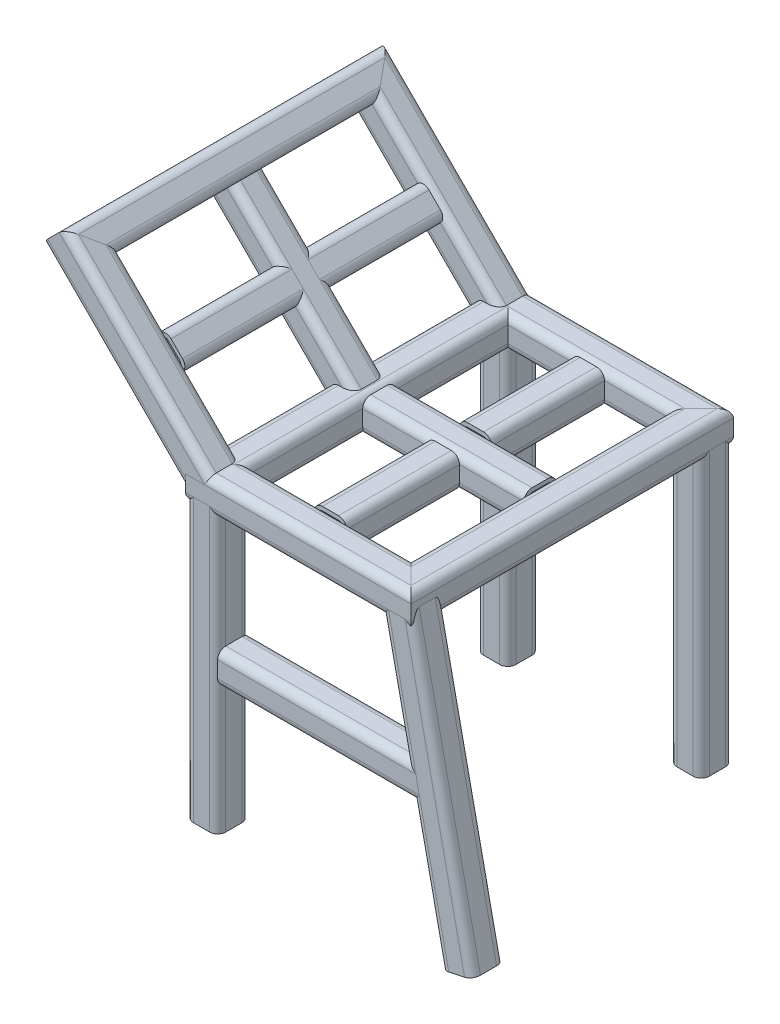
SolidWorks part; units mm, degrees
ref_plane "Front Plane" through (0, 0, 0) normal (0, 0, 1) x (1, 0, 0)
ref_plane "Top Plane" through (0, 0, 0) normal (0, 1, 0) x (1, 0, 0)
ref_plane "Right Plane" through (0, 0, 0) normal (1, 0, 0) x (0, 0, -1)
sketch "Sketch1" plane through (0, 0, 0) normal (0, 1, 0) x (1, 0, 0)
  line L0 (0, -457.2) -> (304.8, -457.2)
  line L1 (0, 0) -> (304.8, 0)
  line L2 (0, 0) -> (0, -457.2)
  line L3 (0, -228.6) -> (304.8, -228.6)
  line L4 (304.8, 0) -> (304.8, -457.2)
  line L5 (152.4, 0) -> (152.4, -228.6)
  line L6 (152.4, -228.6) -> (152.4, -457.2)
  dimension "D1" = 304.8
  dimension "D2" = 457.2
sketch3d "3DSketch1"
  line L0 (0, 0, 0) -> (-215.5261, 215.5261, 0)
  line L1 (-215.5261, 215.5261, 0) -> (-215.5261, 215.5261, 457.2)
  line L2 (-215.5261, 215.5261, 457.2) -> (0, 0, 457.2)
  line L3 (0, 0, 0) -> (0, 0, 457.2) construction
  line L4 (0, 0, 0) -> (304.8, 0, 0) construction
  line L5 (-107.7631, 107.7631, 0) -> (-107.7631, 107.7631, 457.2)
  line L6 (0, 0, 228.6) -> (-215.5261, 215.5261, 228.6)
  dimension "D1" = 304.8
  dimension "D2" = 135
  dimension "D3" = 152.4
sketch "Sketch2" plane through (0, 0, 0) normal (0, 0, 1) x (1, 0, 0)
  line L0 (0, 0) -> (0, -457.2)
  line L1 (304.8, 0) -> (304.8, -457.2)
  dimension "D1" = 457.2
ref_plane "Plane1" through (0, 0, 457.2) normal (0, 0, 1) x (1, 0, 0)
sketch "Sketch3" plane through (0, 0, 457.2) normal (0, 0, 1) x (1, 0, 0)
  line L0 (0, 0) -> (0, -457.2)
  line L1 (304.8, 0) -> (401.9809, -457.2)
  line L2 (0, -228.6) -> (353.3904, -228.6)
  dimension "D1" = 457.2
  dimension "D2" = 12
other "Structural Member1"
ref_plane "Plane5" through (-215.5261, 215.5261, 457.2) normal (0.7071, -0.7071, 0) x (0, 0, -1)
sketch "Sketch111" plane through (-215.5261, 215.5261, 457.2) normal (0.7071, -0.7071, 0) x (0, 0, -1)
  line L0 (-12.7, -19.05) -> (12.7, -19.05)
  line L1 (-19.05, -12.7) -> (-19.05, 12.7)
  line L2 (12.7, 19.05) -> (-12.7, 19.05)
  line L3 (19.05, 12.7) -> (19.05, -12.7)
  line L4 (-12.7, -25.4) -> (12.7, -25.4)
  line L5 (-25.4, -12.7) -> (-25.4, 12.7)
  line L6 (12.7, 25.4) -> (-12.7, 25.4)
  line L7 (25.4, 12.7) -> (25.4, -12.7)
  line L8 (0, 0) -> (19.05, 0) construction
  line L9 (0, 0) -> (0, 19.05) construction
  arc A0 (25.4, 12.7) -> (12.7, 25.4) centre (12.7, 12.7) ccw
  arc A1 (12.7, -25.4) -> (25.4, -12.7) centre (12.7, -12.7) ccw
  arc A2 (-25.4, -12.7) -> (-12.7, -25.4) centre (-12.7, -12.7) ccw
  arc A3 (-12.7, 25.4) -> (-25.4, 12.7) centre (-12.7, 12.7) ccw
  arc A4 (-12.7, 19.05) -> (-19.05, 12.7) centre (-12.7, 12.7) ccw
  arc A5 (19.05, 12.7) -> (12.7, 19.05) centre (12.7, 12.7) ccw
  arc A6 (12.7, -19.05) -> (19.05, -12.7) centre (12.7, -12.7) ccw
  arc A7 (-19.05, -12.7) -> (-12.7, -19.05) centre (-12.7, -12.7) ccw
  point P3 (0, 25.4)
  point P4 (25.4, 0)
  point P5 (0, -25.4)
  point P6 (-25.4, 0)
  point P7 (-25.4, 25.4)
  point P8 (-25.4, -25.4)
  point P33 (0, 0)
  point P35 (25.4, -25.4)
  point P36 (25.4, 25.4)
  point P37 (0, 0)
  dimension "D1" = 12.7
  dimension "Thickness" = 6.35
  dimension "V_leg" = 50.8
other "Structural Member2"
ref_plane "Plane6" through (0, 0, 457.2) normal (1, 0, 0) x (0, 0, -1)
sketch "Sketch15" plane through (0, 0, 457.2) normal (1, 0, 0) x (0, 0, -1)
  line L0 (-12.7, -19.05) -> (12.7, -19.05)
  line L1 (-19.05, -12.7) -> (-19.05, 12.7)
  line L2 (12.7, 19.05) -> (-12.7, 19.05)
  line L3 (19.05, 12.7) -> (19.05, -12.7)
  line L4 (-12.7, -25.4) -> (12.7, -25.4)
  line L5 (-25.4, -12.7) -> (-25.4, 12.7)
  line L6 (12.7, 25.4) -> (-12.7, 25.4)
  line L7 (25.4, 12.7) -> (25.4, -12.7)
  line L8 (0, 0) -> (19.05, 0) construction
  line L9 (0, 0) -> (0, 19.05) construction
  arc A0 (25.4, 12.7) -> (12.7, 25.4) centre (12.7, 12.7) ccw
  arc A1 (12.7, -25.4) -> (25.4, -12.7) centre (12.7, -12.7) ccw
  arc A2 (-25.4, -12.7) -> (-12.7, -25.4) centre (-12.7, -12.7) ccw
  arc A3 (-12.7, 25.4) -> (-25.4, 12.7) centre (-12.7, 12.7) ccw
  arc A4 (-12.7, 19.05) -> (-19.05, 12.7) centre (-12.7, 12.7) ccw
  arc A5 (19.05, 12.7) -> (12.7, 19.05) centre (12.7, 12.7) ccw
  arc A6 (12.7, -19.05) -> (19.05, -12.7) centre (12.7, -12.7) ccw
  arc A7 (-19.05, -12.7) -> (-12.7, -19.05) centre (-12.7, -12.7) ccw
  point P3 (0, 25.4)
  point P4 (25.4, 0)
  point P5 (0, -25.4)
  point P6 (-25.4, 0)
  point P7 (-25.4, 25.4)
  point P8 (-25.4, -25.4)
  point P33 (0, 0)
  point P35 (25.4, -25.4)
  point P36 (25.4, 25.4)
  point P37 (0, 0)
  dimension "D1" = 12.7
  dimension "Thickness" = 6.35
  dimension "V_leg" = 50.8
other "Structural Member3"
ref_plane "Plane7" through (0, 0, 0) normal (0, -1, 0) x (1, 0, 0)
sketch "Sketch16" plane through (0, 0, 0) normal (0, -1, 0) x (1, 0, 0)
  line L0 (-12.7, -19.05) -> (12.7, -19.05)
  line L1 (-19.05, -12.7) -> (-19.05, 12.7)
  line L2 (12.7, 19.05) -> (-12.7, 19.05)
  line L3 (19.05, 12.7) -> (19.05, -12.7)
  line L4 (-12.7, -25.4) -> (12.7, -25.4)
  line L5 (-25.4, -12.7) -> (-25.4, 12.7)
  line L6 (12.7, 25.4) -> (-12.7, 25.4)
  line L7 (25.4, 12.7) -> (25.4, -12.7)
  line L8 (0, 0) -> (19.05, 0) construction
  line L9 (0, 0) -> (0, 19.05) construction
  arc A0 (25.4, 12.7) -> (12.7, 25.4) centre (12.7, 12.7) ccw
  arc A1 (12.7, -25.4) -> (25.4, -12.7) centre (12.7, -12.7) ccw
  arc A2 (-25.4, -12.7) -> (-12.7, -25.4) centre (-12.7, -12.7) ccw
  arc A3 (-12.7, 25.4) -> (-25.4, 12.7) centre (-12.7, 12.7) ccw
  arc A4 (-12.7, 19.05) -> (-19.05, 12.7) centre (-12.7, 12.7) ccw
  arc A5 (19.05, 12.7) -> (12.7, 19.05) centre (12.7, 12.7) ccw
  arc A6 (12.7, -19.05) -> (19.05, -12.7) centre (12.7, -12.7) ccw
  arc A7 (-19.05, -12.7) -> (-12.7, -19.05) centre (-12.7, -12.7) ccw
  point P3 (0, 25.4)
  point P4 (25.4, 0)
  point P5 (0, -25.4)
  point P6 (-25.4, 0)
  point P7 (-25.4, 25.4)
  point P8 (-25.4, -25.4)
  point P33 (0, 0)
  point P35 (25.4, -25.4)
  point P36 (25.4, 25.4)
  point P37 (0, 0)
  dimension "D1" = 12.7
  dimension "Thickness" = 6.35
  dimension "V_leg" = 50.8
other "Structural Member4"
ref_plane "Plane8" through (0, 0, 457.2) normal (0, -1, 0) x (1, 0, 0)
sketch "Sketch17" plane through (0, 0, 457.2) normal (0, -1, 0) x (1, 0, 0)
  line L0 (-12.7, -19.05) -> (12.7, -19.05)
  line L1 (-19.05, -12.7) -> (-19.05, 12.7)
  line L2 (12.7, 19.05) -> (-12.7, 19.05)
  line L3 (19.05, 12.7) -> (19.05, -12.7)
  line L4 (-12.7, -25.4) -> (12.7, -25.4)
  line L5 (-25.4, -12.7) -> (-25.4, 12.7)
  line L6 (12.7, 25.4) -> (-12.7, 25.4)
  line L7 (25.4, 12.7) -> (25.4, -12.7)
  line L8 (0, 0) -> (19.05, 0) construction
  line L9 (0, 0) -> (0, 19.05) construction
  arc A0 (25.4, 12.7) -> (12.7, 25.4) centre (12.7, 12.7) ccw
  arc A1 (12.7, -25.4) -> (25.4, -12.7) centre (12.7, -12.7) ccw
  arc A2 (-25.4, -12.7) -> (-12.7, -25.4) centre (-12.7, -12.7) ccw
  arc A3 (-12.7, 25.4) -> (-25.4, 12.7) centre (-12.7, 12.7) ccw
  arc A4 (-12.7, 19.05) -> (-19.05, 12.7) centre (-12.7, 12.7) ccw
  arc A5 (19.05, 12.7) -> (12.7, 19.05) centre (12.7, 12.7) ccw
  arc A6 (12.7, -19.05) -> (19.05, -12.7) centre (12.7, -12.7) ccw
  arc A7 (-19.05, -12.7) -> (-12.7, -19.05) centre (-12.7, -12.7) ccw
  point P3 (0, 25.4)
  point P4 (25.4, 0)
  point P5 (0, -25.4)
  point P6 (-25.4, 0)
  point P7 (-25.4, 25.4)
  point P8 (-25.4, -25.4)
  point P33 (0, 0)
  point P35 (25.4, -25.4)
  point P36 (25.4, 25.4)
  point P37 (0, 0)
  dimension "D1" = 12.7
  dimension "Thickness" = 6.35
  dimension "V_leg" = 50.8
other "Structural Member5"
ref_plane "Plane9" through (304.8, 0, 457.2) normal (0.2079, -0.9781, 0) x (0.9781, 0.2079, 0)
sketch "Sketch18" plane through (304.8, 0, 457.2) normal (0.2079, -0.9781, 0) x (0.9781, 0.2079, 0)
  line L0 (-12.7, -19.05) -> (12.7, -19.05)
  line L1 (-19.05, -12.7) -> (-19.05, 12.7)
  line L2 (12.7, 19.05) -> (-12.7, 19.05)
  line L3 (19.05, 12.7) -> (19.05, -12.7)
  line L4 (-12.7, -25.4) -> (12.7, -25.4)
  line L5 (-25.4, -12.7) -> (-25.4, 12.7)
  line L6 (12.7, 25.4) -> (-12.7, 25.4)
  line L7 (25.4, 12.7) -> (25.4, -12.7)
  line L8 (0, 0) -> (19.05, 0) construction
  line L9 (0, 0) -> (0, 19.05) construction
  arc A0 (25.4, 12.7) -> (12.7, 25.4) centre (12.7, 12.7) ccw
  arc A1 (12.7, -25.4) -> (25.4, -12.7) centre (12.7, -12.7) ccw
  arc A2 (-25.4, -12.7) -> (-12.7, -25.4) centre (-12.7, -12.7) ccw
  arc A3 (-12.7, 25.4) -> (-25.4, 12.7) centre (-12.7, 12.7) ccw
  arc A4 (-12.7, 19.05) -> (-19.05, 12.7) centre (-12.7, 12.7) ccw
  arc A5 (19.05, 12.7) -> (12.7, 19.05) centre (12.7, 12.7) ccw
  arc A6 (12.7, -19.05) -> (19.05, -12.7) centre (12.7, -12.7) ccw
  arc A7 (-19.05, -12.7) -> (-12.7, -19.05) centre (-12.7, -12.7) ccw
  point P3 (0, 25.4)
  point P4 (25.4, 0)
  point P5 (0, -25.4)
  point P6 (-25.4, 0)
  point P7 (-25.4, 25.4)
  point P8 (-25.4, -25.4)
  point P33 (0, 0)
  point P35 (25.4, -25.4)
  point P36 (25.4, 25.4)
  point P37 (0, 0)
  dimension "D1" = 12.7
  dimension "Thickness" = 6.35
  dimension "V_leg" = 50.8
